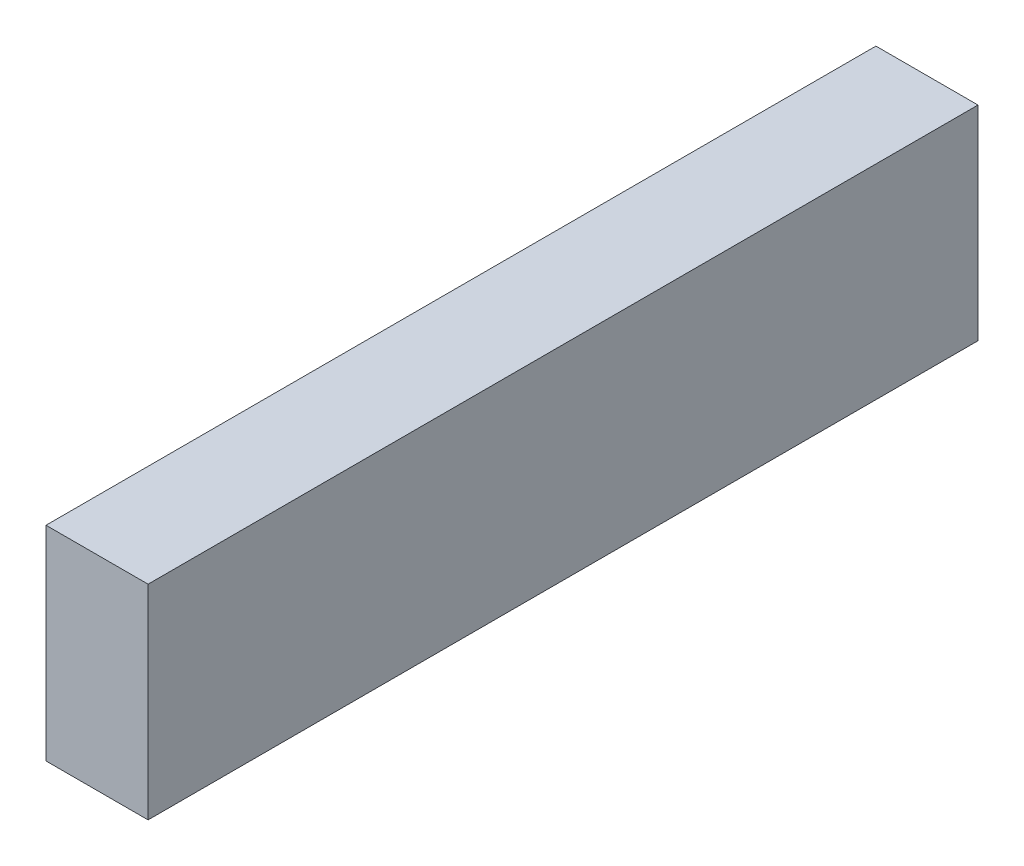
SolidWorks part; units mm, degrees
ref_plane "Piano frontale" through (0, 0, 0) normal (0, 0, 1) x (1, 0, 0)
ref_plane "Piano superiore" through (0, 0, 0) normal (0, 1, 0) x (1, 0, 0)
ref_plane "Piano destro" through (0, 0, 0) normal (1, 0, 0) x (0, 0, -1)
sketch "Sketch1" plane through (0, 0, 0) normal (1, 0, 0) x (0, 0, -1)
  line L1 (-101.8793, -0.429) -> (-93.7493, -0.429)
  line L2 (-101.8793, -0.429) -> (-101.8793, 1.571)
  line L3 (-101.8793, 1.571) -> (-93.7493, 1.571)
  line L4 (-93.7493, -0.429) -> (-93.7493, 1.571)
  dimension "D1" = 8.13
  dimension "D2" = 2
extrude "Boss-Extrude1" add sketch "Sketch1" along normal blind 1
